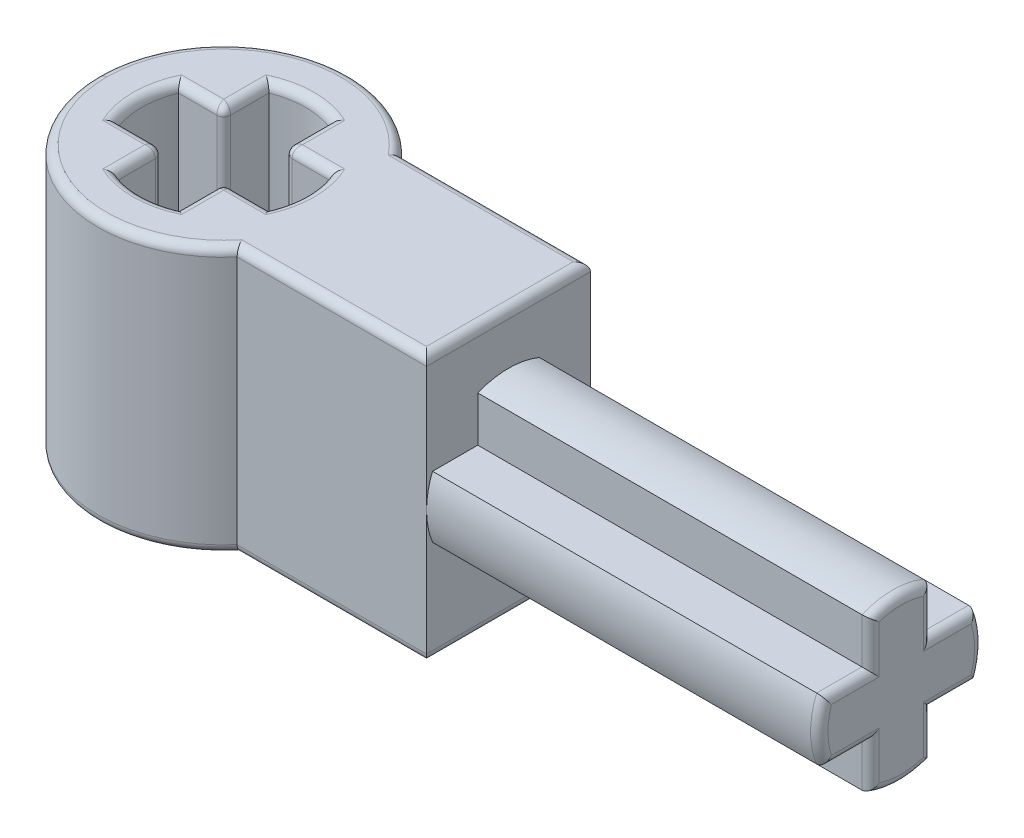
SolidWorks part; units mm, degrees
ref_plane "  " through (0, 0, 0) normal (0, 0, 1) x (1, 0, 0)
ref_plane "Top" through (0, 0, 0) normal (0, 1, 0) x (1, 0, 0)
ref_plane "Right" through (0, 0, 0) normal (1, 0, 0) x (0, 0, -1)
sketch "Sketch1" plane through (0, 0, 0) normal (0, 1, 0) x (1, 0, 0)
  circle A0 centre (0, 0) radius 3.683
  dimension "D1" = 7.366
extrude "Base-Extrude" add sketch "Sketch1" along normal blind 7.8
sketch "Sketch3" plane through (0, 7.8, 0) normal (0, 1, 0) x (1, 0, 0)
  line L0 (-6.6589, 0) -> (6.7957, 0) construction
  line L1 (0, -5.4836) -> (0, 8.3775) construction
sketch "Sketch4" plane through (0, 7.8, 0) normal (0, 1, 0) x (-1, 0, 0)
  line L0 (2.2249, -0.9) -> (1.1, -0.9)
  line L1 (2.2249, 0.9) -> (1.1, 0.9)
  line L2 (0.9, -2.2249) -> (0.9, -1.1)
  line L3 (-0.9, -2.2249) -> (-0.9, -1.1)
  line L4 (6.6589, 0) -> (-6.7957, 0) construction
  line L5 (0, 5.4836) -> (0, -8.3775) construction
  line L6 (-1.1, -0.9) -> (-2.2249, -0.9)
  line L7 (-0.9, 1.1) -> (-0.9, 2.2249)
  line L8 (0.9, 1.1) -> (0.9, 2.2249)
  line L9 (-1.1, 0.9) -> (-2.2249, 0.9)
  arc A0 (-2.2249, 0.9) -> (-2.2249, -0.9) centre (0, 0) ccw
  arc A1 (-0.9, -2.2249) -> (0.9, -2.2249) centre (0, 0) ccw
  arc A2 (2.2249, -0.9) -> (2.2249, 0.9) centre (0, 0) ccw
  arc A3 (0.9, 2.2249) -> (-0.9, 2.2249) centre (0, 0) ccw
  arc A4 (0.9, 1.1) -> (1.1, 0.9) centre (1.1, 1.1) ccw
  arc A5 (-0.9, 1.1) -> (-1.1, 0.9) centre (-1.1, 1.1) cw
  arc A6 (-1.1, -0.9) -> (-0.9, -1.1) centre (-1.1, -1.1) cw
  arc A7 (1.1, -0.9) -> (0.9, -1.1) centre (1.1, -1.1) ccw
  point P22 (-0.9, 0.9)
  dimension "D1" = 4.8
  dimension "D6" = 0.2
  dimension "D2" = 1.8
  dimension "D3" = 1.8
  dimension "D4" = 0.9
  dimension "D5" = 0.9
extrude "Cut-Extrude1" cut sketch "Sketch4" against normal through all
ref_plane "Plane1" through (2.54, 0, 0) normal (1, 0, 0) x (0, 0, -1)
sketch "Sketch6" plane through (2.54, 0, 0) normal (1, 0, 0) x (0, 0, -1)
  line L1 (-2.4, 7.8) -> (2.4, 7.8)
  line L2 (-2.4, 7.8) -> (-2.4, 0)
  line L3 (-2.4, 0) -> (2.4, 0)
  line L4 (2.4, 7.8) -> (2.4, 0)
extrude "Boss-Extrude1" add sketch "Sketch6" along normal blind 5.8
sketch "Sketch7" plane through (8.34, 0, 0) normal (1, 0, 0) x (0, 0, -1)
  line L0 (-2.4, 7.8) -> (2.4, 0) construction
  line L1 (2.4, 7.8) -> (-2.4, 0) construction
  circle A0 centre (0, 3.9) radius 2.4
  dimension "D1" = 4.8
extrude "Boss-Extrude2" add sketch "Sketch7" along normal blind 11.5
sketch "Sketch8" plane through (19.84, 0, 0) normal (1, 0, 0) x (0, 0, -1)
  line L0 (0, 0) -> (0, 7.8) construction
  line L1 (-2.4, 0) -> (2.4, 0) construction
  line L2 (2.4, 7.8) -> (-2.4, 7.8) construction
  line L3 (-2.2249, 4.8) -> (-0.9, 4.8)
  line L4 (-2.2249, 3) -> (-0.9, 3)
  line L5 (0.9, 4.8) -> (2.2249, 4.8)
  line L6 (-0.9, 6.1249) -> (-0.9, 4.8)
  line L7 (0.9, 6.1249) -> (0.9, 4.8)
  line L8 (0.9, 3) -> (0.9, 1.6751)
  line L9 (-0.9, 3) -> (-0.9, 1.6751)
  line L10 (0.9, 3) -> (2.2249, 3)
  arc A0 (-2.2249, 4.8) -> (-2.2249, 3) centre (0, 3.9) ccw
  arc A1 (0.9, 6.1249) -> (-0.9, 6.1249) centre (0, 3.9) ccw
  arc A2 (2.2249, 3) -> (2.2249, 4.8) centre (0, 3.9) ccw
  arc A3 (-0.9, 1.6751) -> (0.9, 1.6751) centre (0, 3.9) ccw
  dimension "D4" = 4.8
  dimension "D1" = 1.8
  dimension "D2" = 0.9
  dimension "D3" = 0.9
  dimension "D5" = 1.8
extrude "Cut-Extrude2" cut sketch "Sketch8" against normal blind 11.5 flip side to cut
fillet "Fillet1" radius 0.254 12 edges at (19.84, 6.3, 0) (19.84, 5.4624, -0.9) (19.84, 4.8, -1.5624) (19.84, 3.9, -2.4) (19.84, 3, -1.5624) (19.84, 2.3376, -0.9) (19.84, 1.5, 0) (19.84, 2.3376, 0.9) (19.84, 3, 1.5624) (19.84, 3.9, 2.4) (19.84, 4.8, 1.5624) (19.84, 5.4624, 0.9)
fillet "Fillet2" radius 0.254 5 edges at (8.34, 7.8, 0) (5.5668, 7.8, 2.4) (-1.2797, 7.8, 3.4535) (-1.2797, 7.8, -3.4535) (5.5668, 7.8, -2.4)
fillet "Fillet3" radius 0.254 21 edges at (-0.9586, 0, -0.9586) (-0.9, 0, -1.6624) (0, 0, -2.4) (0.9, 0, -1.6624) (0.9586, 0, -0.9586) (1.6624, 0, -0.9) (2.4, 0, 0) (1.6624, 0, 0.9) (0.9586, 0, 0.9586) (0.9, 0, 1.6624) (0, 0, 2.4) (-0.9, 0, 1.6624) (-0.9586, 0, 0.9586) (-1.6624, 0, 0.9) (-2.4, 0, 0) (-1.6624, 0, -0.9) (-1.2797, 0, -3.4535) (-1.2797, 0, 3.4535) (5.5668, 0, 2.4) (8.34, 0, 0) (5.5668, 0, -2.4)
fillet "Fillet4" radius 0.254 16 edges at (-1.6624, 7.8, 0.9) (-0.9586, 7.8, 0.9586) (-0.9, 7.8, 1.6624) (0, 7.8, 2.4) (0.9, 7.8, 1.6624) (0.9586, 7.8, 0.9586) (1.6624, 7.8, 0.9) (2.4, 7.8, 0) (1.6624, 7.8, -0.9) (0.9586, 7.8, -0.9586) (0.9, 7.8, -1.6624) (0, 7.8, -2.4) (-0.9, 7.8, -1.6624) (-0.9586, 7.8, -0.9586) (-1.6624, 7.8, -0.9) (-2.4, 7.8, 0)
